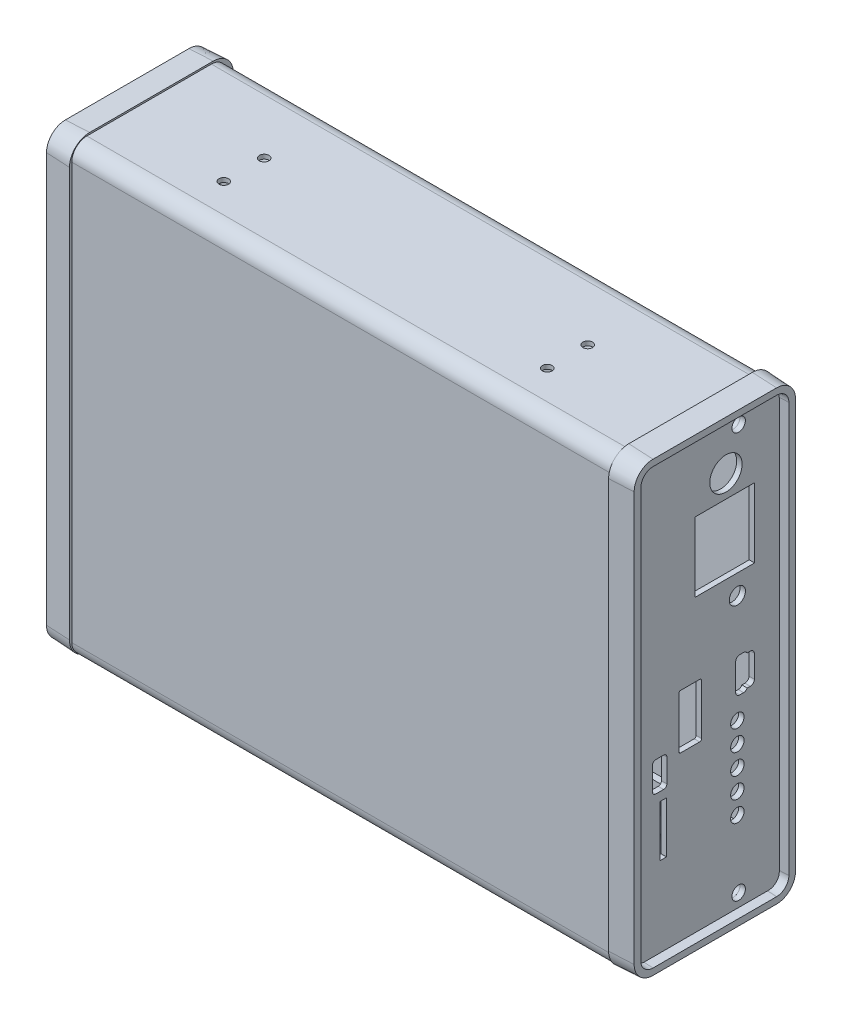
SolidWorks part; units mm, degrees
ref_plane "Front" through (0, 0, 0) normal (0, 0, 1) x (1, 0, 0)
ref_plane "Top" through (0, 0, 0) normal (0, 1, 0) x (1, 0, 0)
ref_plane "Right" through (0, 0, 0) normal (1, 0, 0) x (0, 0, -1)
imported_body "Imported1"
imported_body "Imported2"
imported_body "Imported3"
imported_body "Imported4"
imported_body "Imported5"
imported_body "Imported6"
sketch "Sketch1" plane through (0, 0, -7.9235) normal (0, 0, -1) x (-1, 0, 0)
  line L0 (-155.1291, 173.8496) -> (-282.1291, 173.8496) construction
  line L1 (-259.2681, 150.9896) -> (-271.9681, 150.9896)
  line L2 (-259.2681, 150.9896) -> (-259.2681, 163.6896)
  line L3 (-259.2681, 163.6896) -> (-271.9681, 163.6896)
  line L4 (-271.9681, 150.9896) -> (-271.9681, 163.6896)
  line L5 (-177.9891, 163.6896) -> (-165.2891, 163.6896)
  line L6 (-177.9891, 163.6896) -> (-177.9891, 150.9896)
  line L7 (-177.9891, 150.9896) -> (-165.2891, 150.9896)
  line L8 (-165.2891, 163.6896) -> (-165.2891, 150.9896)
  line L9 (-177.9891, 104.787) -> (-165.2891, 104.787)
  line L10 (-177.9891, 104.787) -> (-177.9891, 92.087)
  line L11 (-177.9891, 92.087) -> (-165.2891, 92.087)
  line L12 (-165.2891, 104.787) -> (-165.2891, 92.087)
  line L13 (-271.9681, 104.787) -> (-259.2681, 104.787)
  line L14 (-271.9681, 104.787) -> (-271.9681, 92.087)
  line L15 (-271.9681, 92.087) -> (-259.2681, 92.087)
  line L16 (-259.2681, 104.787) -> (-259.2681, 92.087)
  line L17 (-282.1281, 79.6791) -> (-282.1281, 176.0975) construction
  line L18 (-282.1291, 81.927) -> (-155.1291, 81.927) construction
  line L19 (-155.1291, 81.927) -> (-155.1291, 173.8496) construction
  dimension "D1" = 12.7
  dimension "D2" = 10.16
  dimension "D3" = 10.16
  dimension "D4" = 10.16
  dimension "D5" = 10.16
extrude "Boss-Extrude1" add sketch "Sketch1" along normal blind 2.54 draft 45
sketch "Sketch2" plane through (0, 0, 0) normal (0, 1, 0) x (1, 0, 0)
  line L0 (282.1291, 7.9235) -> (155.1291, 7.9235) construction
  line L1 (256.7291, -9.8565) -> (180.5291, -9.8565) construction
  line L2 (256.7291, -9.8565) -> (256.7291, -19.3815) construction
  line L3 (256.7291, -19.3815) -> (180.5291, -19.3815) construction
  line L4 (180.5291, -9.8565) -> (180.5291, -19.3815) construction
  line L7 (155.1291, -26.2395) -> (155.1291, 3.0975) construction
  point P0 (256.7291, -9.8565)
  point P1 (180.5291, -19.3815)
  point P2 (256.7291, -19.3815)
  point P3 (180.5291, -9.8565)
  dimension "D1" = 76.2
  dimension "D2" = 9.525
  dimension "D3" = 17.78
  dimension "D4" = 25.4
hole_wizard "#4-40 Tapped Hole1" positions "Sketch4" profile "Sketch5" tap size "#4-40" standard "ANSI Inch"
sketch "Sketch4" plane through (0, 180.4536, 0) normal (0, 1, 0) x (1, 0, 0)
  point P0 (180.5291, -9.8565)
  point P3 (180.5291, -19.3815)
  point P6 (256.7291, -19.3815)
  point P9 (256.7291, -9.8565)
sketch "Sketch5" plane through (180.5291, 180.4536, 9.8565) normal (1, 0, 0) x (0, 0, 1)
  line L0 (0, 0) -> (0, 8.2738)
  line L1 (0, 8.2738) -> (1.1303, 7.5946)
  line L2 (1.1303, 7.5946) -> (1.1303, 0)
  line L5 (1.1303, 0) -> (0, 0)
  line L10 (0, 8.2738) -> (-1.1303, 7.5946) construction
  line L11 (0, -6.35) -> (0, 107.95) construction
  dimension "Tap Drill Dia." = 2.2606
  dimension "Tap Drill Depth" = 7.5946
  dimension "Drill Angle" = 118
hole_wizard "#4-40 Tapped Hole2" positions "Sketch6" profile "Sketch7" tap size "#4-40" standard "ANSI Inch"
sketch "Sketch6" plane through (0, 75.323, 0) normal (0, -1, 0) x (-1, 0, 0)
  point P0 (-256.7291, -9.8565)
  point P3 (-256.7291, -19.3815)
  point P6 (-180.5291, -19.3815)
  point P9 (-180.5291, -9.8565)
sketch "Sketch7" plane through (256.7291, 75.323, 9.8565) normal (1, 0, 0) x (0, 0, -1)
  line L0 (0, 0) -> (0, 8.2738)
  line L1 (0, 8.2738) -> (1.1303, 7.5946)
  line L2 (1.1303, 7.5946) -> (1.1303, 0)
  line L5 (1.1303, 0) -> (0, 0)
  line L10 (0, 8.2738) -> (-1.1303, 7.5946) construction
  line L11 (0, -6.35) -> (0, 107.95) construction
  dimension "Tap Drill Dia." = 2.2606
  dimension "Tap Drill Depth" = 7.5946
  dimension "Drill Angle" = 118
